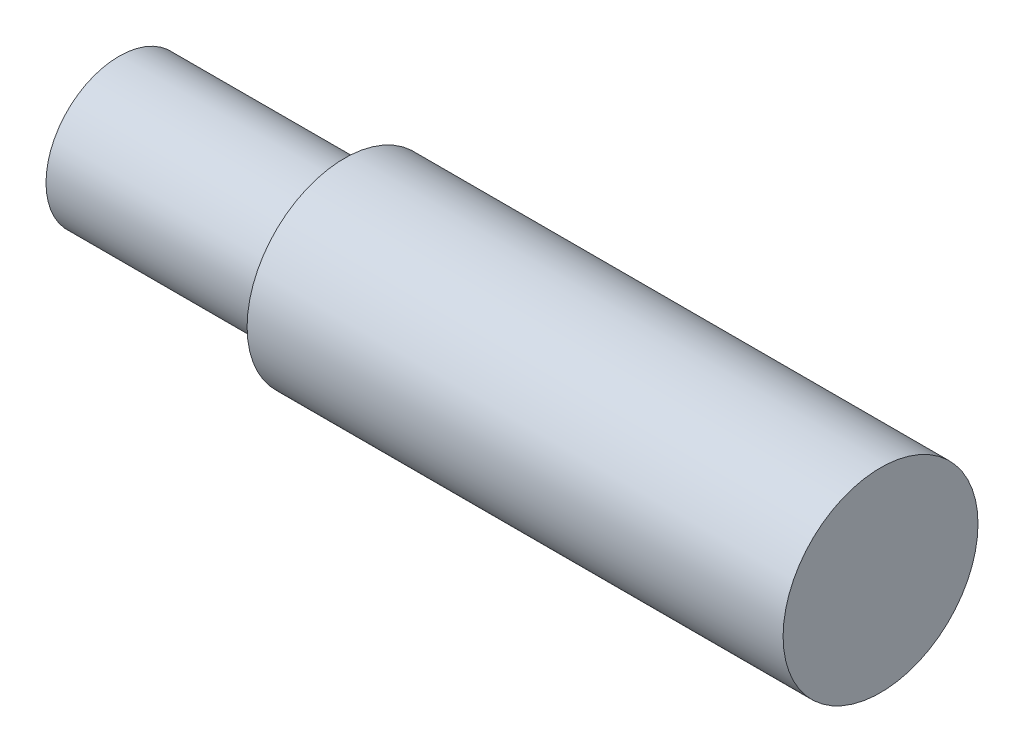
SolidWorks part; units mm, degrees
ref_plane "Front" through (0, 0, 0) normal (0, 0, 1) x (1, 0, 0)
ref_plane "Top" through (0, 0, 0) normal (0, 1, 0) x (1, 0, 0)
ref_plane "Right" through (0, 0, 0) normal (1, 0, 0) x (0, 0, -1)
sketch "Sketch1" plane through (0, 0, 0) normal (0, 1, 0) x (1, 0, 0)
  line L0 (0, 0) -> (32, 0)
  line L1 (32, 0) -> (32, 4)
  line L2 (0.7465, 3) -> (10, 3)
  line L3 (10, 3) -> (10, 4)
  line L5 (10, 4) -> (32, 4)
  line L6 (10, 0) -> (10, 4) construction
  line L7 (0, 3) -> (32, 3) construction
  arc A0 (0.7465, 3) -> (0, 0) centre (6.4013, 0) ccw
  dimension "D3" = 6.4013
  dimension "D1" = 22
  dimension "D2" = 10
  dimension "D4" = 4
  dimension "D5" = 3
revolve "Revolve1" add sketch "Sketch1" angle 360 about L0
